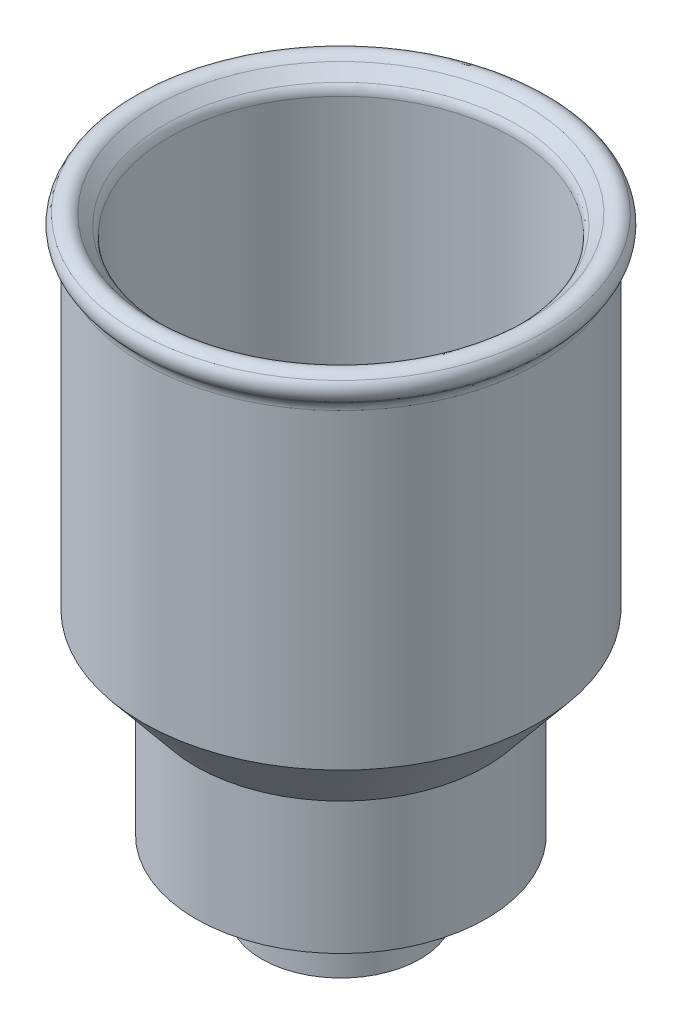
SolidWorks part; units mm, degrees
ref_plane "Plan de face" through (0, 0, 0) normal (0, 0, 1) x (1, 0, 0)
ref_plane "Plan de dessus" through (0, 0, 0) normal (0, 1, 0) x (1, 0, 0)
ref_plane "Plan de droite" through (0, 0, 0) normal (1, 0, 0) x (0, 0, -1)
sketch "Esquisse1" plane through (0, 0, 0) normal (0, 0, 1) x (1, 0, 0)
  line L0 (3.889, 30.342) -> (3.889, 5.9048) construction
  line L1 (3.889, 19.451) -> (3.889, 33.451) construction
  line L2 (3.889, 36.9682) -> (3.889, -0.2231) construction
  line L3 (0.889, 8.0221) -> (0.889, 5.451) construction
  line L4 (0.889, 8.0221) -> (0.889, 5.451)
  line L5 (9.389, 8.0221) -> (-1.611, 8.0221) construction
  line L6 (0.889, 8.0221) -> (-1.611, 8.0221)
  line L7 (-1.611, 13.0221) -> (-1.611, 8.0221) construction
  line L8 (-1.611, 13.0221) -> (-1.611, 8.0221)
  line L9 (-3.611, 15.451) -> (-1.611, 13.0221) construction
  line L10 (-3.611, 15.451) -> (-1.611, 13.0221)
  line L11 (-3.611, 23.451) -> (-3.611, 15.451) construction
  line L12 (-3.611, 27.451) -> (-3.611, 15.451)
  line L13 (-3.611, 27.451) -> (-4.217, 28.0571)
  dimension "D1" = 12
revolve "Révol.-Mince1" add sketch "Esquisse1" angle 360 about L0
fillet "Congé1" radius 0.5 4 edges at (3.889, 28.0571, 8.1061) (3.889, 27.8653, 6.5) (3.889, 28.7642, 7.399) (3.889, 27.451, 7.5)
